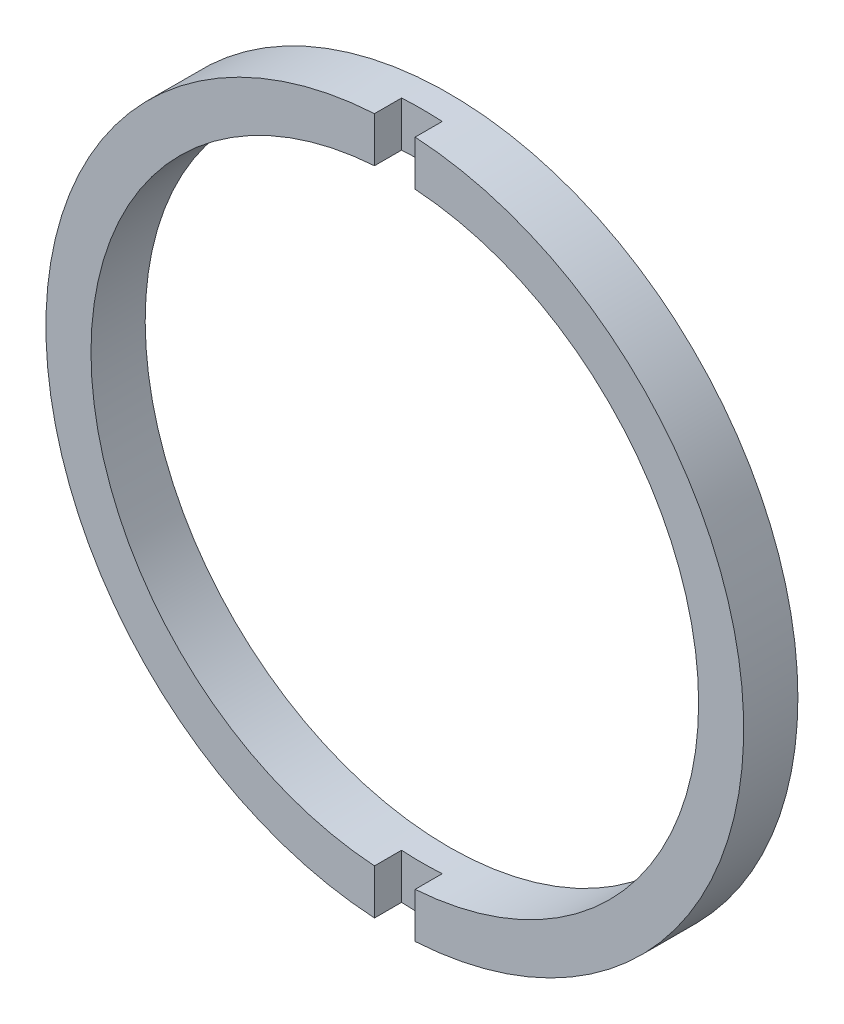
SolidWorks part; units mm, degrees
ref_plane "前视基准面" through (0, 0, 0) normal (0, 0, 1) x (1, 0, 0)
ref_plane "上视基准面" through (0, 0, 0) normal (0, 1, 0) x (1, 0, 0)
ref_plane "右视基准面" through (0, 0, 0) normal (1, 0, 0) x (0, 0, -1)
other "Configuration Table"
sketch "草图1" plane through (0, 0, 0) normal (0, 0, 1) x (1, 0, 0)
  circle A0 centre (0, 0) radius 25.75
  circle A1 centre (0, 0) radius 22.4231
extrude "凸台-拉伸1" add sketch "草图1" along normal blind 4
sketch "草图2" plane through (0, 0, 4) normal (0, 0, 1) x (1, 0, 0)
  line L1 (-1.5, -29.1614) -> (1.5, -29.1614)
  line L2 (-1.5, -29.1614) -> (-1.5, 29.1614)
  line L3 (-1.5, 29.1614) -> (1.5, 29.1614)
  line L4 (1.5, -29.1614) -> (1.5, 29.1614)
  line L5 (-1.5, -29.1614) -> (1.5, 29.1614) construction
  line L6 (-1.5, 29.1614) -> (1.5, -29.1614) construction
  circle A0 centre (0, 0) radius 29.2 construction
  point P0 (0, 0)
  dimension "D1" = 3
extrude "切除-拉伸1" cut sketch "草图2" against normal blind 2
